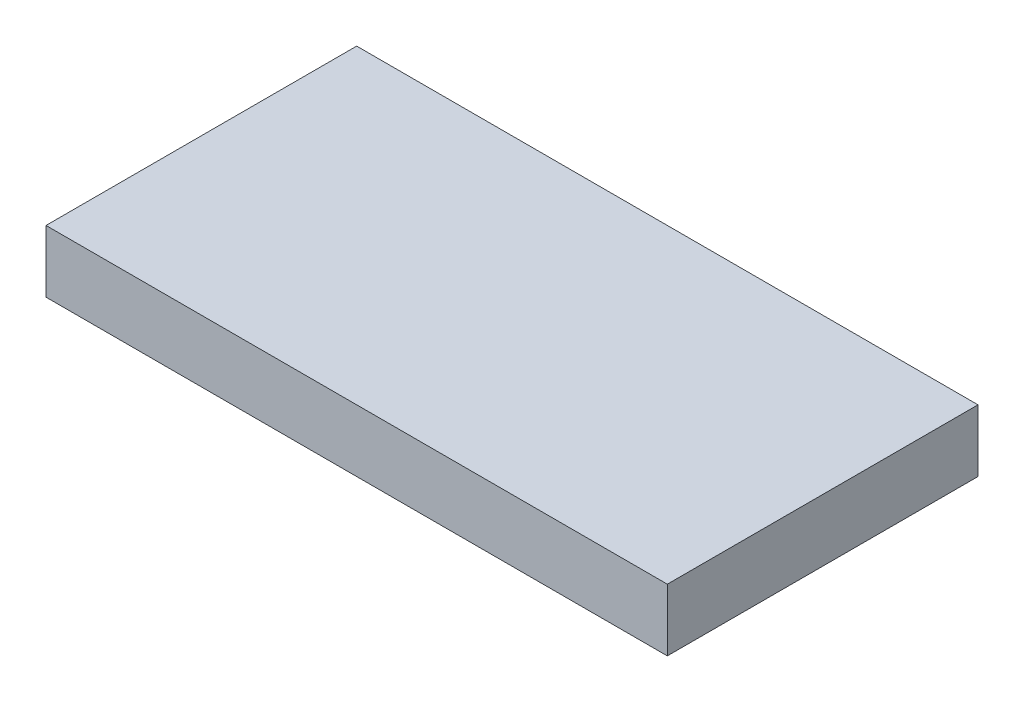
SolidWorks part; units mm, degrees
ref_plane "Front Plane" through (0, 0, 0) normal (0, 0, 1) x (1, 0, 0)
ref_plane "Top Plane" through (0, 0, 0) normal (0, 1, 0) x (1, 0, 0)
ref_plane "Right Plane" through (0, 0, 0) normal (1, 0, 0) x (0, 0, -1)
sketch "Sketch1" plane through (0, 0, 0) normal (0, 1, 0) x (1, 0, 0)
  line L1 (-127, -63.5) -> (127, -63.5)
  line L2 (-127, -63.5) -> (-127, 63.5)
  line L3 (-127, 63.5) -> (127, 63.5)
  line L4 (127, -63.5) -> (127, 63.5)
  line L5 (-127, -63.5) -> (127, 63.5) construction
  line L6 (-127, 63.5) -> (127, -63.5) construction
  point P0 (0, 0)
  dimension "D1" = 254
  dimension "D2" = 127
extrude "Boss-Extrude1" add sketch "Sketch1" along normal blind 25.4
